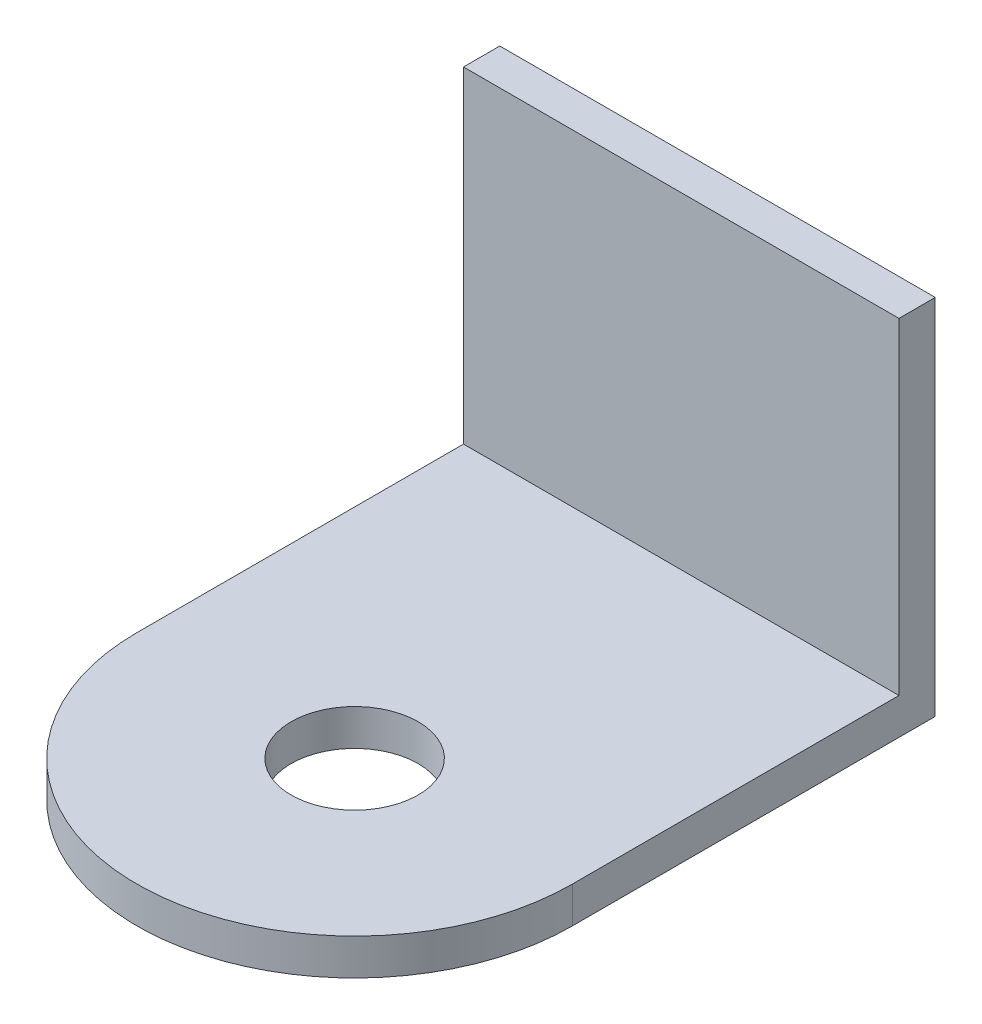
SolidWorks part; units mm, degrees
ref_plane "Front Plane" through (0, 0, 0) normal (0, 0, 1) x (1, 0, 0)
ref_plane "Top Plane" through (0, 0, 0) normal (0, 1, 0) x (1, 0, 0)
ref_plane "Right Plane" through (0, 0, 0) normal (1, 0, 0) x (0, 0, -1)
sketch "Sketch1" plane through (0, 0, 0) normal (0, 0, 1) x (1, 0, 0)
  line L1 (0, 0) -> (12, 0)
  line L2 (0, 0) -> (0, 10)
  line L3 (0, 10) -> (12, 10)
  line L4 (12, 0) -> (12, 10)
  dimension "D1" = 10
  dimension "D2" = 12
extrude "Extrude1" add sketch "Sketch1" along normal blind 1
sketch "Sketch2" plane through (0, 0, 0) normal (0, -1, 0) x (1, 0, 0)
  line L1 (12, 0) -> (0, 0)
  line L2 (12, 0) -> (12, 10)
  line L4 (0, 0) -> (0, 10)
  arc A0 (12, 10) -> (0, 10) centre (6, 10) ccw
  circle A1 centre (6, 10) radius 1.75
  dimension "D1" = 3.5
  dimension "D3" = 10
  dimension "D4" = 10
  dimension "D5" = 6
  dimension "D2" = 12
extrude "Extrude2" add sketch "Sketch2" against normal blind 1
